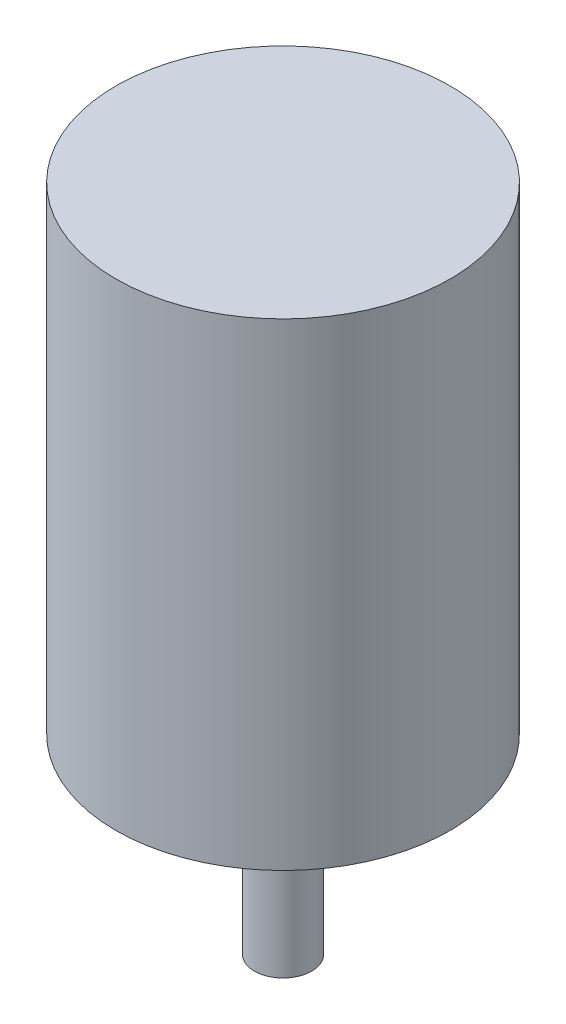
SolidWorks part; units mm, degrees
ref_plane "Alzado" through (0, 0, 0) normal (0, 0, 1) x (1, 0, 0)
ref_plane "Planta" through (0, 0, 0) normal (0, 1, 0) x (1, 0, 0)
ref_plane "Vista lateral" through (0, 0, 0) normal (1, 0, 0) x (0, 0, -1)
sketch "Croquis2" plane through (0, 0, 0) normal (0, 1, 0) x (1, 0, 0)
  circle A0 centre (0, 0) radius 87.5
  dimension "D1" = 175
extrude "Saliente-Extruir1" add sketch "Croquis2" against normal blind 250
sketch "Croquis7" plane through (0, 0, 0) normal (0, 0, 1) x (1, 0, 0)
  line L0 (0, 0) -> (0, -523.7259) construction
  line L1 (0, -288.0492) -> (0, 288.0492) construction
sketch "Croquis3" plane through (0, -250, 0) normal (0, -1, 0) x (1, 0, 0)
  circle A0 centre (0, 0) radius 15
  dimension "D1" = 30
extrude "Saliente-Extruir2" add sketch "Croquis3" along normal blind 100
ref_plane "Plano1" through (0, 0, 70) normal (0, 0, 1) x (1, 0, 0)
